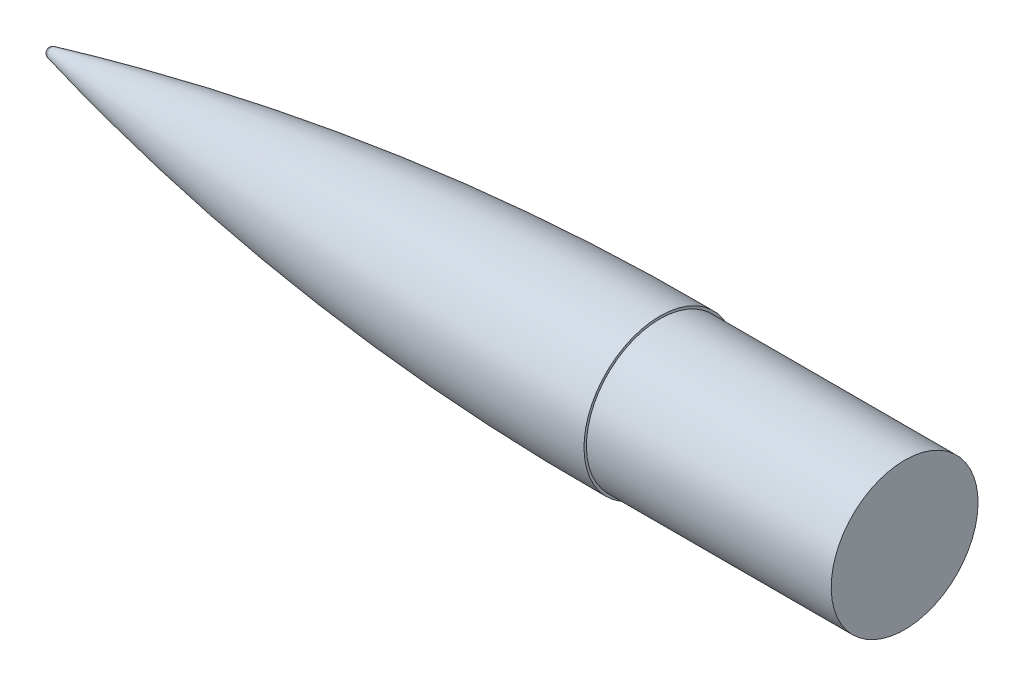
SolidWorks part; units mm, degrees
ref_plane "Front Plane" through (0, 0, 0) normal (0, 0, 1) x (1, 0, 0)
ref_plane "Top Plane" through (0, 0, 0) normal (0, 1, 0) x (1, 0, 0)
ref_plane "Right Plane" through (0, 0, 0) normal (1, 0, 0) x (0, 0, -1)
sketch "Sketch1" plane through (0, 0, 0) normal (0, 0, 1) x (1, 0, 0)
  line L0 (0, 0) -> (325.525, 0) construction
  line L1 (325.525, 0) -> (325.525, 39.37) construction
  line L2 (8.025, 0) -> (8.025, 30.9534) construction
  line L3 (452.525, 0) -> (8.025, 0)
  line L4 (325.525, 38.1) -> (452.525, 38.1)
  line L5 (452.525, 38.1) -> (452.525, 0)
  line L6 (325.525, 38.1) -> (325.525, 39.37)
  arc A1 (9.9641, 2.4679) -> (8.025, 0) centre (10.565, 0) ccw
  arc A2 (325.525, 39.37) -> (9.9641, 2.4679) centre (317.6933, -1261.3375) ccw
  arc A3 (13.105, 0) -> (9.9641, 2.4679) centre (10.565, 0) ccw construction
  arc A4 (8.025, 0) -> (13.105, 0) centre (10.565, 0) ccw construction
  arc A5 (8.025, 1.9942) -> (0, 0) centre (317.6933, -1261.3375) ccw construction
  arc A6 (9.9641, 2.4679) -> (8.025, 1.9942) centre (317.6933, -1261.3375) ccw construction
  point P4 (10.565, 0)
  point P5 (9.9641, 2.4679)
  point P11 (8.025, 0)
revolve "Revolve2" add sketch "Sketch1" angle 360 about L3
equation "\"r_n\"= 0.1'nose tip radius"
equation "\"R_nc\"= 3.1 / 2'nosecone base radius"
equation "\"L_nc\"= 12.5'exposed length of the nosecone"
equation "\"rho\"= ( \"R_nc\" ^ 2 + \"L_nc\" ^ 2 ) / ( 2 * \"R_nc\" )'ogive radius"
equation "\"x_0\"= \"L_nc\" - sqr ( ( \"rho\" - \"r_n\" ) ^ 2 - ( \"rho\" - \"R_nc\" ) ^ 2 )'center of tip sphere"
equation "\"y_t\"= \"r_n\" * ( \"rho\" - \"R_nc\" ) / ( \"rho\" - \"r_n\" )'y-coordinate of tangency point"
equation "\"x_t\"= \"x_0\" - sqr ( \"r_n\" ^ 2 - \"y_t\" ^ 2 )'x-coordinate of tangency point"
equation "\"x_a\"= \"x_0\" - \"r_n\"'apex point"
equation "\"D1@Sketch1\"=\"R_nc\""
equation "\"D2@Sketch1\"=\"x_0\""
equation "\"D3@Sketch1\"=\"y_t\""
equation "\"D4@Sketch1\"=\"x_t\""
equation "\"D5@Sketch1\"=\"L_nc\""
equation "\"t_nc\"= 3 / 32'wall thickness of nosecone"
equation "\"L_s\"= 5'length of shoulder"
equation "\"R_s\"= 3 / 2'radius of shoulder"
equation "\"t_s\"= 3 / 32'wall thickness of shoulder"
equation "\"D6@Sketch1\"=\"R_s\""
equation "\"D7@Sketch1\"=\"L_s\""
